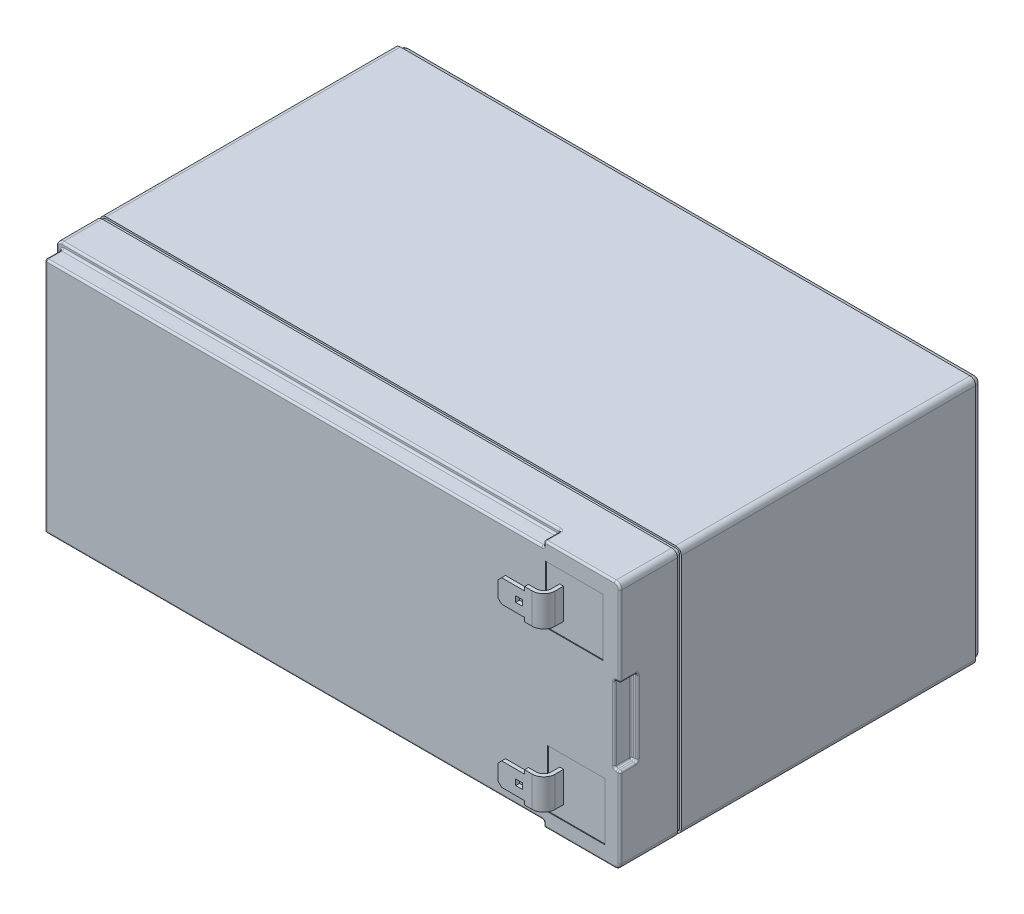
SolidWorks part; units mm, degrees
ref_plane "Plan de face" through (0, 0, 0) normal (0, 0, 1) x (1, 0, 0)
ref_plane "Plan de dessus" through (0, 0, 0) normal (0, 1, 0) x (1, 0, 0)
ref_plane "Plan de droite" through (0, 0, 0) normal (1, 0, 0) x (0, 0, -1)
sketch "Esquisse1" plane through (0, 0, 0) normal (0, 0, 1) x (1, 0, 0)
  line L1 (0, 0) -> (152, 0)
  line L2 (0, 0) -> (0, 65)
  line L3 (0, 65) -> (152, 65)
  line L4 (152, 0) -> (152, 65)
  dimension "D1" = 152
  dimension "D2" = 65
extrude "Extrusion1" add sketch "Esquisse1" along normal blind 95
sketch "Esquisse2" plane through (0, 0, 0) normal (0, 0, -1) x (-1, 0, 0)
  line L0 (-0.5, 0.5) -> (-0.5, 64.5)
  line L1 (-0.5, 64.5) -> (-151.5, 64.5)
  line L2 (-151.5, 64.5) -> (-151.5, 0.5)
  line L3 (-151.5, 0.5) -> (-0.5, 0.5)
  line L4 (0, 0) -> (0, 65)
  line L5 (0, 65) -> (-152, 65)
  line L6 (-152, 65) -> (-152, 0)
  line L7 (-152, 0) -> (0, 0)
  line L8 (0, 0) -> (0, 65)
  line L9 (0, 65) -> (-152, 65)
  line L10 (-152, 65) -> (-152, 0)
  line L11 (-152, 0) -> (0, 0)
  dimension "D1" = 0
  dimension "D2" = 0.5
extrude "Enlèv. mat.-Extru.1" cut sketch "Esquisse2" against normal blind 2
fillet "Congé1" radius 1.5 4 edges at (76, 64.5, 0) (0.5, 32.5, 0) (76, 0.5, 0) (151.5, 32.5, 0)
fillet "Congé2" radius 1.5 12 edges at (0.9393, 64.0607, 0.4393) (0.9393, 0.9393, 0.4393) (151.0607, 0.9393, 0.4393) (151.0607, 64.0607, 0.4393) (0.5, 64.5, 1.75) (0.5, 0.5, 1.75) (151.5, 0.5, 1.75) (151.5, 64.5, 1.75) (152, 65, 48.5) (152, 0, 48.5) (0, 65, 48.5) (0, 0, 48.5)
ref_plane "Plan1" through (0, 0, 80) normal (0, 0, 1) x (1, 0, 0)
sketch "Esquisse3" plane through (0, 0, 80) normal (0, 0, 1) x (1, 0, 0)
  line L0 (151.5, 1.5) -> (151.5, 63.5)
  line L1 (150.5, 64.5) -> (1.5, 64.5)
  line L2 (0.5, 63.5) -> (0.5, 1.5)
  line L3 (1.5, 0.5) -> (150.5, 0.5)
  line L4 (152, 1.5) -> (152, 63.5)
  line L5 (150.5, 65) -> (1.5, 65)
  line L6 (0, 63.5) -> (0, 1.5)
  line L7 (1.5, 0) -> (150.5, 0)
  line L8 (152, 1.5) -> (152, 63.5)
  line L9 (150.5, 65) -> (1.5, 65)
  line L10 (0, 63.5) -> (0, 1.5)
  line L11 (1.5, 0) -> (150.5, 0)
  arc A0 (151.5, 63.5) -> (150.5, 64.5) centre (150.5, 63.5) ccw
  arc A1 (1.5, 64.5) -> (0.5, 63.5) centre (1.5, 63.5) ccw
  arc A2 (0.5, 1.5) -> (1.5, 0.5) centre (1.5, 1.5) ccw
  arc A3 (150.5, 0.5) -> (151.5, 1.5) centre (150.5, 1.5) ccw
  arc A4 (152, 63.5) -> (150.5, 65) centre (150.5, 63.5) ccw
  arc A5 (1.5, 65) -> (0, 63.5) centre (1.5, 63.5) ccw
  arc A6 (0, 1.5) -> (1.5, 0) centre (1.5, 1.5) ccw
  arc A7 (150.5, 0) -> (152, 1.5) centre (150.5, 1.5) ccw
  arc A8 (152, 63.5) -> (150.5, 65) centre (150.5, 63.5) ccw
  arc A9 (1.5, 65) -> (0, 63.5) centre (1.5, 63.5) ccw
  arc A10 (0, 1.5) -> (1.5, 0) centre (1.5, 1.5) ccw
  arc A11 (150.5, 0) -> (152, 1.5) centre (150.5, 1.5) ccw
  dimension "D1" = 0
  dimension "D2" = 0.5
extrude "Enlèv. mat.-Extru.2" cut sketch "Esquisse3" against normal blind 1
sketch "Esquisse4" plane through (0, 0, 95) normal (0, 0, 1) x (1, 0, 0)
  line L0 (150.5, 22.5) -> (150.5, 42.5)
  line L1 (132, 63.5) -> (1.5, 63.5)
  line L2 (1.5, 63.5) -> (1.5, 1.5)
  line L3 (1.5, 1.5) -> (132, 1.5)
  line L4 (152, 1.5) -> (152, 63.5)
  line L5 (150.5, 65) -> (1.5, 65)
  line L6 (0, 63.5) -> (0, 1.5)
  line L7 (1.5, 0) -> (150.5, 0)
  line L8 (157.0533, 42.5) -> (157.0533, 22.5)
  line L9 (132, 65) -> (1.5, 65)
  line L10 (0, 63.5) -> (0, 1.5)
  line L11 (1.5, 0) -> (132, 0)
  line L12 (132, 65) -> (132, 63.5)
  line L13 (132, 1.5) -> (132, 0)
  line L14 (150.5, 42.5) -> (157.0533, 42.5)
  line L15 (150.5, 22.5) -> (157.0533, 22.5)
  line L16 (150.5, 65) -> (1.5, 65) construction
  line L17 (150.5, 63.5) -> (1.5, 63.5) construction
  line L18 (150.5, 1.5) -> (150.5, 63.5) construction
  line L19 (152, 1.5) -> (152, 63.5) construction
  line L20 (1.5, 1.5) -> (150.5, 1.5) construction
  line L21 (1.5, 0) -> (150.5, 0) construction
  line L22 (152, 1.5) -> (152, 63.5) construction
  line L23 (152, 32.5) -> (136.8678, 32.5) construction
  arc A1 (1.5, 63.5) -> (1.5, 63.5) centre (1.5, 63.5) ccw
  arc A2 (1.5, 1.5) -> (1.5, 1.5) centre (1.5, 1.5) ccw
  arc A4 (152, 63.5) -> (150.5, 65) centre (150.5, 63.5) ccw
  arc A5 (1.5, 65) -> (0, 63.5) centre (1.5, 63.5) ccw
  arc A6 (0, 1.5) -> (1.5, 0) centre (1.5, 1.5) ccw
  arc A7 (150.5, 0) -> (152, 1.5) centre (150.5, 1.5) ccw
  arc A9 (1.5, 65) -> (0, 63.5) centre (1.5, 63.5) ccw
  arc A10 (0, 1.5) -> (1.5, 0) centre (1.5, 1.5) ccw
  arc A12 (152, 63.5) -> (150.5, 65) centre (150.5, 63.5) ccw construction
  arc A13 (150.5, 0) -> (152, 1.5) centre (150.5, 1.5) ccw construction
  arc A14 (150.5, 63.5) -> (150.5, 63.5) centre (150.5, 63.5) ccw construction
  arc A15 (150.5, 1.5) -> (150.5, 1.5) centre (150.5, 1.5) ccw construction
  dimension "D3" = 20
  dimension "D4" = 20
  dimension "D1" = 0
  dimension "D2" = 1.5
extrude "Enlèv. mat.-Extru.3" cut sketch "Esquisse4" against normal blind 4.5
fillet "Congé3" radius 0.5 38 edges at (151.25, 22.5, 95) (152, 12, 95) (151.5607, 0.4393, 95) (141.25, 0, 95) (132, 0.75, 95) (66.75, 1.5, 95) (1.5, 32.5, 95) (66.75, 63.5, 95) (132, 64.25, 95) (141.25, 65, 95) (151.5607, 64.5607, 95) (152, 53, 95) (151.25, 42.5, 95) (150.5, 32.5, 95) (132, 0, 92.75) (132, 65, 92.75) (66.75, 65, 90.5) (132, 64.25, 90.5) (132, 0.75, 90.5) (66.75, 0, 90.5) (0.4393, 0.4393, 90.5) (0, 32.5, 90.5) (0.4393, 64.5607, 90.5) (152, 22.5, 92.75) (152, 42.5, 92.75) (152, 32.5, 90.5) (151.25, 22.5, 90.5) (151.25, 42.5, 90.5) (150.5, 42.5, 92.75) (150.5, 32.5, 90.5) (150.5, 22.5, 92.75) (132, 1.5, 92.75) (66.75, 1.5, 90.5) (1.5, 1.5, 92.75) (1.5, 32.5, 90.5) (1.5, 63.5, 92.75) (66.75, 63.5, 90.5) (132, 63.5, 92.75)
sketch "Esquisse5" plane through (0, 0, 95) normal (0, 0, 1) x (1, 0, 0)
  line L0 (152, 22) -> (152, 1.5) construction
  line L1 (148, 4) -> (133, 4)
  line L2 (148, 4) -> (148, 19)
  line L3 (148, 19) -> (133, 19)
  line L4 (133, 4) -> (133, 19)
  line L5 (150.5, 0) -> (132.5, 0) construction
  dimension "D1" = 4
  dimension "D2" = 4
  dimension "D3" = 15
  dimension "D4" = 15
extrude "Enlèv. mat.-Extru.4" cut sketch "Esquisse5" against normal blind 0.2
sketch "Esquisse6" plane through (0, 0, 95) normal (0, 0, 1) x (1, 0, 0)
  line L0 (152, 63.5) -> (152, 43) construction
  line L1 (147.5, 60.5) -> (132.5, 60.5)
  line L2 (147.5, 60.5) -> (147.5, 45.5)
  line L3 (147.5, 45.5) -> (132.5, 45.5)
  line L4 (132.5, 60.5) -> (132.5, 45.5)
  line L5 (132.5, 65) -> (150.5, 65) construction
  dimension "D1" = 15
  dimension "D2" = 15
  dimension "D3" = 4.5
  dimension "D4" = 4.5
extrude "Enlèv. mat.-Extru.5" cut sketch "Esquisse6" against normal blind 0.2
sketch "Esquisse7" plane through (0, 0, 94.8) normal (0, 0, 1) x (1, 0, 0)
  line L0 (133, 11.5) -> (142.1568, 11.5) construction
  line L1 (137, 15.5) -> (136, 15.5)
  line L2 (137, 15.5) -> (137, 7.5)
  line L3 (137, 7.5) -> (136, 7.5)
  line L4 (136, 15.5) -> (136, 7.5)
  line L5 (133, 19) -> (133, 4) construction
  line L6 (133, 19) -> (133, 4) construction
  dimension "D1" = 8
  dimension "D2" = 4
  dimension "D3" = 3
  dimension "D4" = 1
ref_plane "Plan2" through (0, 7.5, 0) normal (0, -1, 0) x (1, 0, 0)
sketch "Esquisse8" plane through (0, 7.5, 0) normal (0, -1, 0) x (1, 0, 0)
  line L0 (136, 94.8) -> (136, 97)
  line L3 (137, 94.8) -> (136, 94.8) construction
  line L4 (133, 94.8) -> (142.1568, 94.8) construction
  line L5 (134, 99) -> (125, 99)
  line L6 (2, 95) -> (131.5, 95) construction
  arc A0 (136, 97) -> (134, 99) centre (134, 97) ccw
  dimension "D1" = 2
  dimension "D2" = 4
  dimension "D3" = 11
sweep "Balayage1" add profiles "Esquisse7" path "Esquisse8"
sketch "Esquisse9" plane through (0, 0, 100) normal (0, 0, 1) x (1, 0, 0)
  line L0 (125, 11.5) -> (133.4907, 11.5) construction
  line L1 (125, 7.5) -> (125, 15.5) construction
  line L2 (134, 7.5) -> (125, 7.5) construction
  line L3 (125, 7.5) -> (132, 7.5)
  line L4 (125, 7.5) -> (125, 8.5)
  line L5 (125, 8.5) -> (132, 8.5)
  line L6 (132, 7.5) -> (132, 8.5)
  line L7 (132, 15.5) -> (132, 14.5)
  line L8 (125, 14.5) -> (132, 14.5)
  line L9 (125, 15.5) -> (125, 14.5)
  line L10 (125, 15.5) -> (132, 15.5)
  line L12 (129.6778, 12.25) -> (131.4985, 12.25)
  line L13 (129.6778, 12.25) -> (129.6778, 10.75)
  line L14 (129.6778, 10.75) -> (131.4985, 10.75)
  line L15 (131.4985, 12.25) -> (131.4985, 10.75)
  dimension "D1" = 1
  dimension "D2" = 7
  dimension "D3" = 1.5
extrude "Enlèv. mat.-Extru.6" cut sketch "Esquisse9" against normal blind 1
chamfer "Chanfrein1" distance 1 angle 45 2 edges at (125, 8.5, 99.5) (125, 14.5, 99.5)
pattern_linear "Répétition linéaire1" count 2 spacing 41.5 along (0, 1, 0) of "Balayage1", "Enlèv. mat.-Extru.6", "Chanfrein1"
